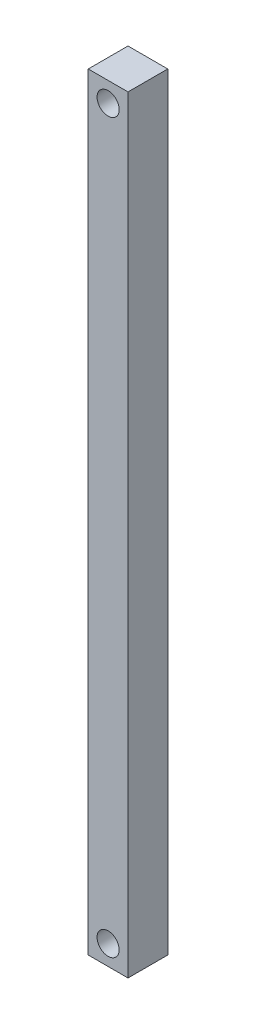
SolidWorks part; units mm, degrees
ref_plane "Front Plane" through (0, 0, 0) normal (0, 0, 1) x (1, 0, 0)
ref_plane "Top Plane" through (0, 0, 0) normal (0, 1, 0) x (1, 0, 0)
ref_plane "Right Plane" through (0, 0, 0) normal (1, 0, 0) x (0, 0, -1)
sketch "Sketch1" plane through (0, 0, 0) normal (0, 0, 1) x (1, 0, 0)
  line L0 (55, 0) -> (-55, 0) construction
  line L1 (-3.7697, 0) -> (14.9303, 0)
  line L2 (-3.7697, 0) -> (-3.7697, 361)
  line L3 (-3.7697, 361) -> (14.9303, 361)
  line L4 (14.9303, 0) -> (14.9303, 361)
  line L5 (5.5803, 361) -> (5.5803, 0) construction
  circle A0 centre (5.5803, 351.65) radius 5.2
  circle A1 centre (5.5803, 9.35) radius 5.2
  dimension "D3" = 10.4
  dimension "D1" = 18.7
  dimension "D2" = 361
  dimension "D4" = 9.35
  dimension "D6" = 9.35
extrude "Boss-Extrude1" add sketch "Sketch1" along normal blind 18.7
